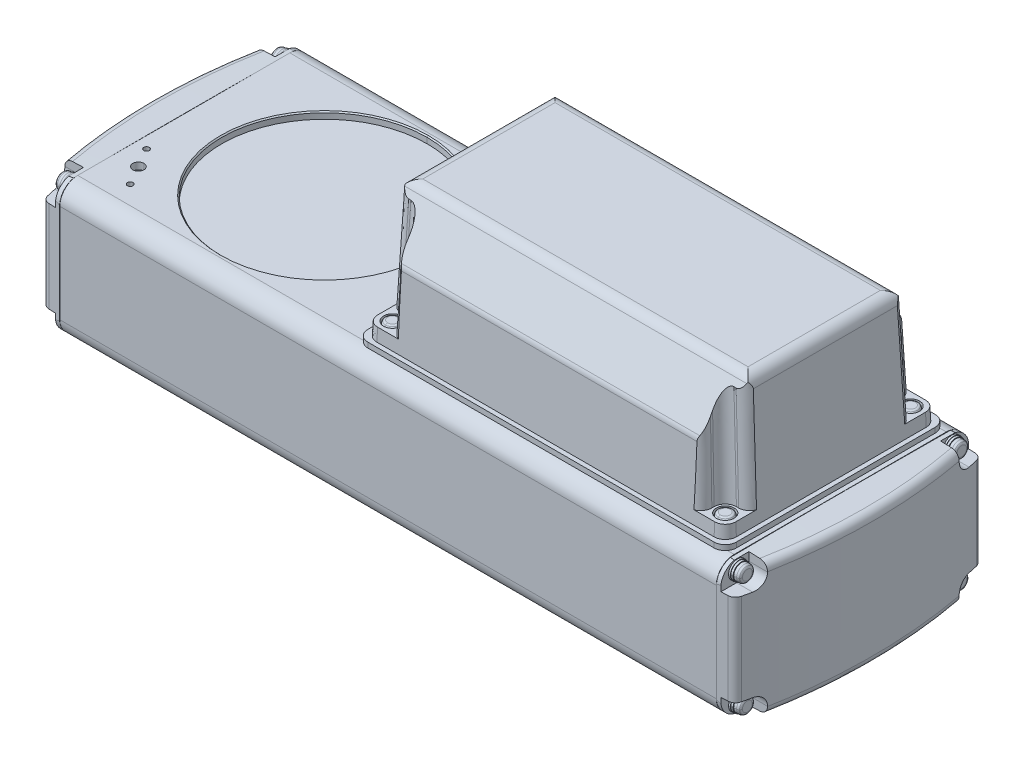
SolidWorks part; units mm, degrees
ref_plane "Front Plane" through (0, 0, 0) normal (0, 0, 1) x (1, 0, 0)
ref_plane "Top Plane" through (0, 0, 0) normal (0, 1, 0) x (1, 0, 0)
ref_plane "Right Plane" through (0, 0, 0) normal (1, 0, 0) x (0, 0, -1)
imported_body "Surface-Imported1"
sketch "Sketch1" plane through (0, 0, 0) normal (0, -1, 0) x (1, 0, 0)
  line L0 (56, 47.5) -> (56, -47.5) construction
  circle A0 centre (0, 0) radius 10
  dimension "D2" = 20
  dimension "D1" = 56
extrude "Boss-Extrude1" add sketch "Sketch1" along normal blind 0.1
